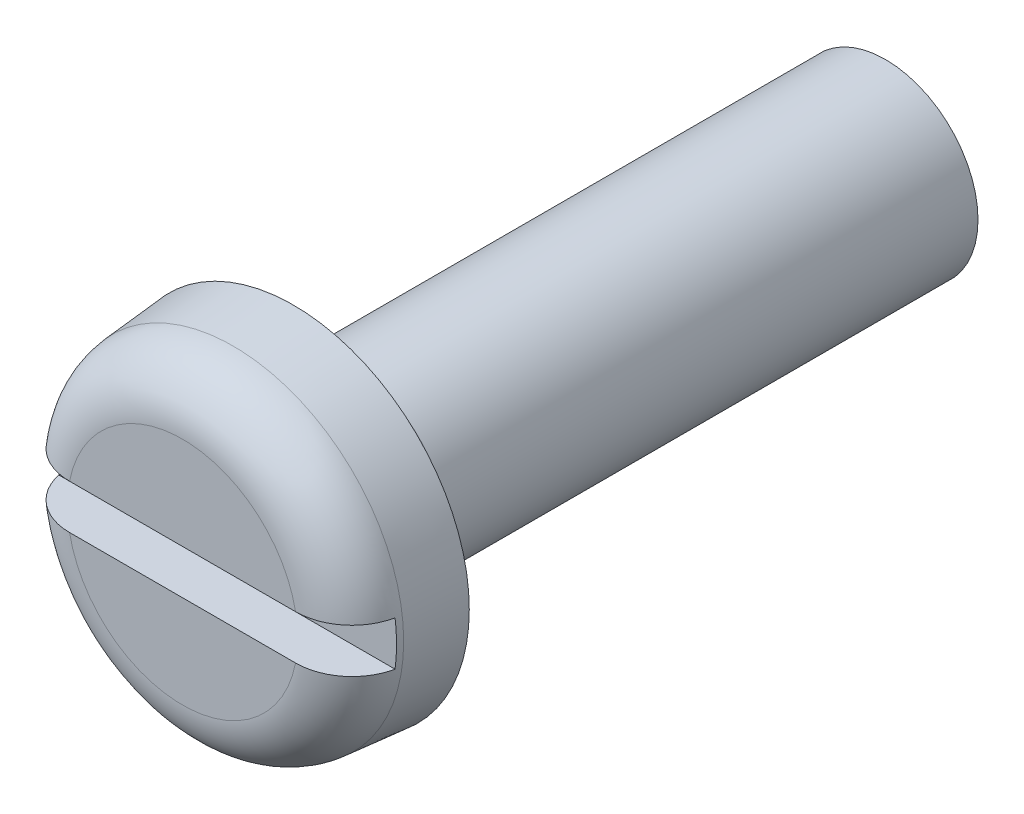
SolidWorks part; units mm, degrees
ref_plane "Face" through (0, 0, 0) normal (0, 0, 1) x (1, 0, 0)
ref_plane "Dessus" through (0, 0, 0) normal (0, 1, 0) x (1, 0, 0)
ref_plane "Droite" through (0, 0, 0) normal (1, 0, 0) x (0, 0, -1)
imported_body "Imported1"
sketch "Sketch1" plane through (0, 0, -6) normal (0, 0, -1) x (-1, 0, 0)
  circle A0 centre (0, 0) radius 2.5
extrude "Extrude1" add sketch "Sketch1" along normal blind 10
